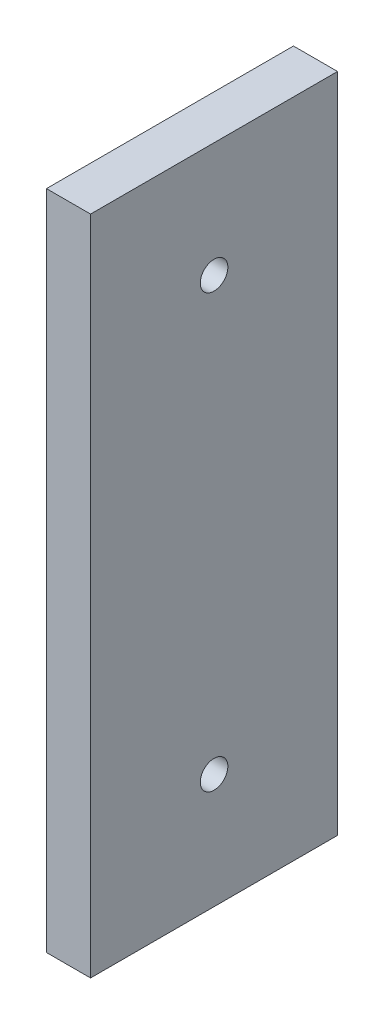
SolidWorks part; units mm, degrees
ref_plane "Front Plane" through (0, 0, 0) normal (0, 0, 1) x (1, 0, 0)
ref_plane "Top Plane" through (0, 0, 0) normal (0, 1, 0) x (1, 0, 0)
ref_plane "Right Plane" through (0, 0, 0) normal (1, 0, 0) x (0, 0, -1)
sketch "Sketch1" plane through (0, 0, 0) normal (1, 0, 0) x (0, 0, -1)
  line L1 (-17.78, 47.625) -> (17.78, 47.625)
  line L2 (-17.78, 47.625) -> (-17.78, -47.625)
  line L3 (-17.78, -47.625) -> (17.78, -47.625)
  line L4 (17.78, 47.625) -> (17.78, -47.625)
  line L5 (-17.78, 47.625) -> (17.78, -47.625) construction
  line L6 (-17.78, -47.625) -> (17.78, 47.625) construction
  point P1 (0, 0)
  dimension "D1" = 95.25
  dimension "D2" = 35.56
extrude "Boss-Extrude1" add sketch "Sketch1" along normal blind 6.35
sketch "Sketch5" plane through (0, 0, 0) normal (-1, 0, 0) x (0, 0, 1)
  line L0 (-17.78, 47.625) -> (17.78, 47.625) construction
  point P0 (0, 31.115)
  point P1 (0, 47.625)
  dimension "D1" = 16.51
sketch "Sketch16" plane through (0, 0, 0) normal (-1, 0, 0) x (0, 0, 1)
  line L0 (17.78, -47.625) -> (-17.78, -47.625) construction
  point P0 (0, -31.115)
  dimension "D1" = 16.51
hole_wizard "5/32 (0.15625) Diameter Hole1" positions "3DSketch5" profile "Sketch19" hole size "5/32" standard "Ansi Inch"
sketch3d "3DSketch5"
  point P0 (0, -31.115, 0)
  point P3 (0, 31.115, 0)
sketch "Sketch19" plane through (0, -31.115, 0) normal (0, 1, 0) x (0, 0, 1)
  line L0 (0, 0) -> (0, 26.5923)
  line L1 (0, 26.5923) -> (1.9844, 25.4)
  line L2 (1.9844, 25.4) -> (1.9844, 0)
  line L5 (1.9844, 0) -> (0, 0)
  line L10 (0, 26.5923) -> (-1.9844, 25.4) construction
  line L11 (0, -6.35) -> (0, 107.95) construction
  dimension "Hole Dia." = 3.9688
  dimension "Hole Depth" = 25.4
  dimension "Drill Angle" = 118
